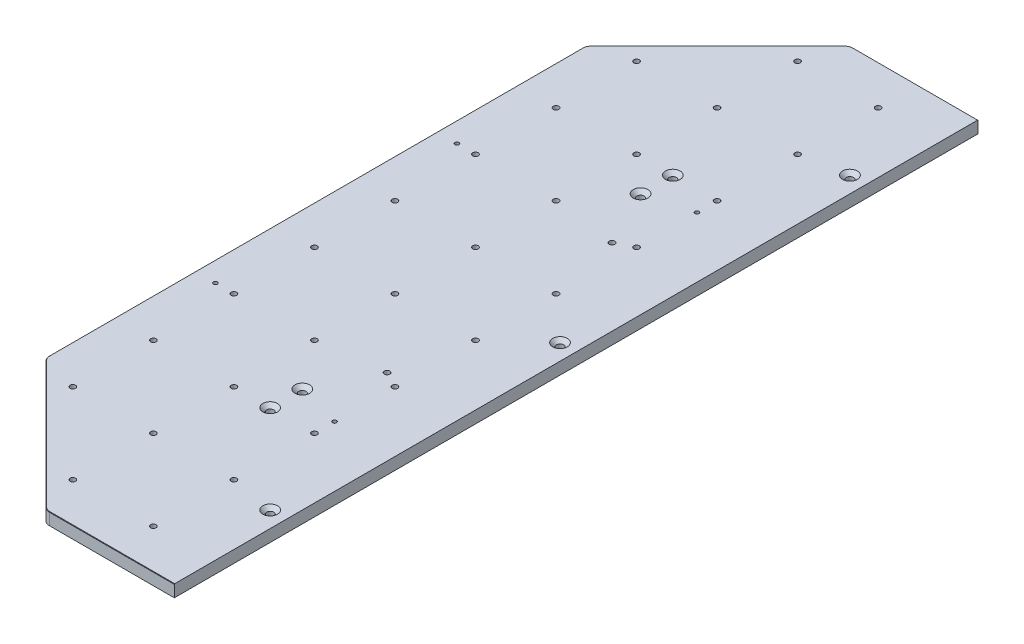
SolidWorks part; units mm, degrees
ref_plane "Ebene vorne" through (0, 0, 0) normal (0, 0, 1) x (1, 0, 0)
ref_plane "Ebene oben" through (0, 0, 0) normal (0, 1, 0) x (1, 0, 0)
ref_plane "Ebene rechts" through (0, 0, 0) normal (1, 0, 0) x (0, 0, -1)
sketch "Skizze1" plane through (0, 0, 0) normal (0, 1, 0) x (1, 0, 0)
  line L0 (-688, 499) -> (-748, 439)
  line L1 (-688, -499) -> (688, -499)
  line L2 (-688, -499) -> (-688, 499) construction
  line L3 (-688, 499) -> (688, 499)
  line L4 (688, -499) -> (688, 499) construction
  line L5 (-688, -499) -> (688, 499) construction
  line L6 (-688, 499) -> (688, -499) construction
  line L7 (-748, 439) -> (-748, -439)
  line L8 (-688, -499) -> (-748, -439)
  line L10 (688, -499) -> (748, -439)
  line L11 (748, -439) -> (748, 439)
  line L12 (748, 439) -> (688, 499)
  line L13 (-748, 0) -> (0, 0) construction
  point P0 (0, 0)
  dimension "D1" = 1496
  dimension "D2" = 998
  dimension "D3" = 60
  dimension "D4" = 45
extrude "Aufsatz-Linear austragen1" add sketch "Skizze1" along normal blind 15
hole_wizard "RoboterP1_M8 Gewindebohrung1" positions "Skizze4" profile "Skizze5" tap size "M8" standard "DIN"
sketch "Skizze4" plane through (0, 15, 0) normal (0, 1, 0) x (1, 0, 0)
  line L0 (-688, -499) -> (688, -499) construction
  line L1 (0, -181.5) -> (-197.5, -181.5) construction
  line L2 (-197.5, -181.5) -> (0, 16) construction
  line L3 (0, 16) -> (197.5, -181.5) construction
  line L4 (197.5, -181.5) -> (0, -379) construction
  line L5 (0, -379) -> (-197.5, -181.5) construction
  line L7 (-139.6536, -321.1536) -> (139.6536, -41.8464) construction
  line L8 (-139.6536, -41.8464) -> (139.6536, -321.1536) construction
  circle A0 centre (0, -181.5) radius 197.5 construction
  point P21 (-139.6536, -321.1536)
  point P22 (139.6536, -41.8464)
  point P23 (-139.6536, -41.8464)
  point P24 (139.6536, -321.1536)
  dimension "D1" = 395
  dimension "D2" = 120
sketch "Skizze5" plane through (139.6536, 15, 321.1536) normal (1, 0, 0) x (0, 0, 1)
  line L0 (0, 0) -> (0, 15)
  line L1 (0, 15) -> (3.4, 15)
  line L2 (3.4, 15) -> (3.4, 0)
  line L5 (3.4, 0) -> (0, 0)
  line L11 (0, -6.35) -> (0, 107.95) construction
  dimension "Bohrerdurchmesser" = 6.8
  dimension "Bohrungstiefe" = 15
hole_wizard "RoboterP2_M8 Gewindebohrung1" positions "Skizze6" profile "Skizze7" tap size "M8" standard "DIN"
sketch "Skizze6" plane through (0, 15, 0) normal (0, 1, 0) x (1, 0, 0)
  line L1 (240.8464, -139.6536) -> (520.1536, -139.6536) construction
  line L2 (240.8464, -139.6536) -> (240.8464, 139.6536) construction
  line L3 (240.8464, 139.6536) -> (520.1536, 139.6536) construction
  line L4 (520.1536, -139.6536) -> (520.1536, 139.6536) construction
  line L5 (240.8464, -139.6536) -> (520.1536, 139.6536) construction
  line L6 (240.8464, 139.6536) -> (520.1536, -139.6536) construction
  line L7 (748, -439) -> (748, 439) construction
  circle A0 centre (380.5, 0) radius 197.5 construction
  point P5 (520.1536, 139.6536)
  point P8 (240.8464, -139.6536)
  point P9 (240.8464, 139.6536)
  point P10 (520.1536, -139.6536)
  dimension "D1" = 395
  dimension "D2" = 170
sketch "Skizze7" plane through (520.1536, 15, 139.6536) normal (1, 0, 0) x (0, 0, 1)
  line L0 (0, 0) -> (0, 15)
  line L1 (0, 15) -> (3.4, 15)
  line L2 (3.4, 15) -> (3.4, 0)
  line L5 (3.4, 0) -> (0, 0)
  line L11 (0, -6.35) -> (0, 107.95) construction
  dimension "Bohrerdurchmesser" = 6.8
  dimension "Bohrungstiefe" = 15
hole_wizard "Raster_M8 Gewindebohrung3" positions "Skizze9" profile "Skizze10" tap size "M8" standard "DIN"
sketch "Skizze9" plane through (0, 15, 0) normal (0, 1, 0) x (1, 0, 0)
  point P0 (-700, -450)
  dimension "D1" = 700
  dimension "D2" = 450
sketch "Skizze10" plane through (-700, 15, 450) normal (1, 0, 0) x (0, 0, 1)
  line L0 (0, 0) -> (0, 15)
  line L1 (0, 15) -> (3.4, 15)
  line L2 (3.4, 15) -> (3.4, 0)
  line L5 (3.4, 0) -> (0, 0)
  line L11 (0, -6.35) -> (0, 107.95) construction
  dimension "Bohrerdurchmesser" = 6.8
  dimension "Bohrungstiefe" = 15
pattern_linear "RoboterP3_M8 Gewindebohrung1" count 2 spacing 150 along (0, 0, -1) of "RoboterP1_M8 Gewindebohrung1"
hole_wizard "Formsenkung für M8 Senkschraube mit Innensechskant1" positions "Skizze2" profile "Skizze3" countersink size "M8" standard "DIN"
sketch "Skizze2" plane through (0, 15, 0) normal (0, 1, 0) x (1, 0, 0)
  line L1 (445, -360) -> (-445, -360)
  line L2 (445, -360) -> (445, 360)
  line L3 (445, 360) -> (-445, 360)
  line L4 (-445, -360) -> (-445, 360)
  line L5 (445, -360) -> (-445, 360) construction
  line L6 (445, 360) -> (-445, -360) construction
  line L7 (0, 0) -> (-610.081, 0) construction
  line L8 (-555, 210) -> (-555, -210) construction
  line L13 (0, 0) -> (0, -385.3386) construction
  line L18 (555, 210) -> (555, -210) construction
  line L19 (-20, 360) -> (-20, -360)
  line L21 (20, 360) -> (20, -360)
  line L22 (-555, 250) -> (-555, 210) construction
  line L24 (-555, -210) -> (-555, -250) construction
  line L26 (555, -210) -> (555, -250) construction
  line L28 (555, 210) -> (555, 250) construction
  line L29 (445, 0) -> (405, 0) construction
  point P2 (-445, 360)
  point P5 (445, -360)
  point P6 (445, 360)
  point P7 (-445, -360)
  point P98 (-555, 210)
  point P100 (-555, -210)
  point P123 (555, 210)
  point P125 (555, -210)
  point P139 (-20, 360)
  point P142 (20, 360)
  point P145 (-20, -360)
  point P148 (20, -360)
  point P150 (-20, 0)
  point P152 (20, 0)
  point P174 (-555, 250)
  point P177 (-555, -250)
  point P180 (555, -250)
  point P183 (555, 250)
  point P184 (-405, 360)
  point P186 (405, 360)
  point P188 (405, -360)
  point P190 (-405, -360)
  point P191 (-445, 0)
  point P193 (-405, 0)
  point P195 (445, 0)
  point P197 (405, 0)
  dimension "D1" = 890
  dimension "D2" = 720
  dimension "D3" = 40
  dimension "D4" = 1110
  dimension "D5" = 500
  dimension "D6" = 40
  dimension "D7" = 40
  dimension "D8" = 40
  dimension "D9" = 40
  dimension "D10" = 40
  dimension "D11" = 40
  dimension "D12" = 40
sketch "Skizze3" plane through (-445, 15, -360) normal (1, 0, 0) x (0, 0, 1)
  line L0 (0, 0) -> (0, 15)
  line L1 (0, 15) -> (4.5, 15)
  line L2 (4.5, 15) -> (4.5, 4.625)
  line L3 (4.5, 4.625) -> (9.125, 0)
  line L5 (9.125, 0) -> (0, 0)
  line L6 (-4.5, 4.625) -> (-9.125, 0) construction
  line L11 (0, -6.35) -> (0, 107.95) construction
  dimension "Bohrerdurchmesser" = 9
  dimension "Bohrungstiefe" = 15
  dimension "Senkdurchmesser (Oben)" = 18.25
  dimension "Senkwinkel (Oben)" = 90
sketch "Skizze8" plane through (0, 15, 0) normal (0, 1, 0) x (1, 0, 0)
  line L1 (100, 300) -> (200, 300)
  line L2 (95, 305) -> (95, 337)
  line L3 (100, 342) -> (200, 342)
  line L4 (205, 305) -> (205, 337)
  line L5 (95, 300) -> (205, 342) construction
  line L6 (95, 342) -> (205, 300) construction
  arc A0 (95, 305) -> (100, 300) centre (100, 305) ccw
  arc A1 (200, 300) -> (205, 305) centre (200, 305) ccw
  arc A2 (205, 337) -> (200, 342) centre (200, 337) ccw
  arc A3 (100, 342) -> (95, 337) centre (100, 337) ccw
  point P0 (150, 321)
  dimension "D5" = 5
  dimension "D1" = 150
  dimension "D2" = 110
  dimension "D3" = 42
  dimension "D4" = 321
extrude "Schnitt-Linear austragen1" cut sketch "Skizze8" against normal through all
hole_wizard "M5 Gewindebohrung1" positions "Skizze17" profile "Skizze18" tap size "M5" standard "DIN"
sketch "Skizze17" plane through (0, 15, 0) normal (0, 1, 0) x (1, 0, 0)
  line L0 (150, 342) -> (150, 300) construction
  line L1 (200, 342) -> (100, 342) construction
  line L2 (100, 300) -> (200, 300) construction
  line L3 (95, 321) -> (150, 321) construction
  line L4 (95, 337) -> (95, 305) construction
  line L5 (150, 321) -> (205, 321) construction
  line L6 (205, 305) -> (205, 337) construction
  point P17 (85, 337)
  point P19 (85, 305)
  point P21 (215, 305)
  point P23 (215, 337)
  dimension "D1" = 32
  dimension "D2" = 130
sketch "Skizze18" plane through (215, 15, -337) normal (1, 0, 0) x (0, 0, 1)
  line L0 (0, 0) -> (0, 13.2618)
  line L1 (0, 13.2618) -> (2.1, 12)
  line L2 (2.1, 12) -> (2.1, 0)
  line L5 (2.1, 0) -> (0, 0)
  line L10 (0, 13.2618) -> (-2.1, 12) construction
  line L11 (0, -6.35) -> (0, 107.95) construction
  dimension "Bohrerdurchmesser" = 4.2
  dimension "Bohrungstiefe" = 12
  dimension "Spitzenwinkel" = 118
sketch "Skizze11" plane through (0, 15, 0) normal (0, 1, 0) x (1, 0, 0)
  line L0 (0, 0) -> (0, 417.1845) construction
  line L1 (688, 499) -> (-688, 499) construction
  line L2 (-270, 469) -> (-270, 499) construction
  line L3 (-305.1, 499) -> (-234.9, 499)
  line L4 (-305.1, 499) -> (-305.1, 474)
  line L5 (-300.1, 469) -> (-239.9, 469)
  line L6 (-234.9, 499) -> (-234.9, 474)
  line L7 (234.9, 499) -> (234.9, 474)
  line L8 (300.1, 469) -> (239.9, 469)
  line L9 (305.1, 499) -> (305.1, 474)
  line L10 (305.1, 499) -> (234.9, 499)
  arc A0 (-234.9, 474) -> (-239.9, 469) centre (-239.9, 474) cw
  arc A1 (-300.1, 469) -> (-305.1, 474) centre (-300.1, 474) cw
  arc A2 (300.1, 469) -> (305.1, 474) centre (300.1, 474) ccw
  arc A3 (234.9, 474) -> (239.9, 469) centre (239.9, 474) ccw
  point P12 (-234.9, 469)
  point P15 (-305.1, 469)
  point P25 (305.1, 469)
  point P26 (234.9, 469)
  dimension "D3" = 5
  dimension "D1" = 30
  dimension "D2" = 70.2
  dimension "D4" = 270
extrude "Schnitt-Linear austragen2" cut sketch "Skizze11" against normal blind 5
fillet "Verrundung2" radius 2 4 edges at (-234.9, 12.5, -499) (-305.1, 12.5, -499) (305.1, 12.5, -499) (234.9, 12.5, -499)
hole_wizard "M6 Gewindebohrung1" positions "Skizze12" profile "Skizze13" tap size "M6" standard "DIN"
sketch "Skizze12" plane through (0, 10, 0) normal (0, 1, 0) x (1, 0, 0)
  line L0 (-270, 95.0617) -> (-270, 484) construction
  line L1 (-270, 484) -> (-287.5, 484) construction
  line L3 (-270, 484) -> (-252.5, 484) construction
  line L6 (-300.1, 469) -> (-239.9, 469) construction
  line L7 (-270, 484) -> (-270, 499) construction
  line L8 (-232.9, 499) -> (-307.1, 499) construction
  point P0 (-287.5, 484)
  point P4 (-252.5, 484)
  dimension "D1" = 35
  dimension "D2" = 15
sketch "Skizze13" plane through (-287.5, 10, -484) normal (1, 0, 0) x (0, 0, 1)
  line L0 (0, 0) -> (0, 10)
  line L1 (0, 10) -> (2.5, 10)
  line L2 (2.5, 10) -> (2.5, 0)
  line L5 (2.5, 0) -> (0, 0)
  line L11 (0, -6.35) -> (0, 107.95) construction
  dimension "Bohrerdurchmesser" = 5
  dimension "Bohrungstiefe" = 10
mirror "Spiegeln3" about plane through (0, 0, 0) normal (1, 0, 0) of "RoboterP2_M8 Gewindebohrung1"
mirror "Spiegeln2" about plane through (0, 0, 0) normal (1, 0, 0) of "M6 Gewindebohrung1"
pattern_linear "Raster_M8 Gewindebohrung4" count 15 spacing 100 along (1, 0, 0) count 10 spacing 100 along (0, 0, -1) of "Raster_M8 Gewindebohrung3"
hole_wizard "Ø5.0mm Stiftloch1" positions "Skizze14" profile "Skizze15" hole size "Ø5.0" standard "DIN"
sketch "Skizze14" plane through (0, 15, 0) normal (0, 1, 0) x (1, 0, 0)
  line L1 (-500, -225) -> (500, -225)
  line L2 (-500, -225) -> (-500, 225)
  line L3 (-500, 225) -> (500, 225)
  line L4 (500, -225) -> (500, 225)
  line L5 (-500, -225) -> (500, 225) construction
  line L6 (-500, 225) -> (500, -225) construction
  point P2 (500, 225)
  point P5 (-500, -225)
  point P6 (-500, 225)
  point P7 (500, -225)
  dimension "D1" = 1000
  dimension "D2" = 450
sketch "Skizze15" plane through (500, 15, -225) normal (1, 0, 0) x (0, 0, 1)
  line L0 (0, 0) -> (0, 9.5022)
  line L1 (0, 9.5022) -> (2.5, 8)
  line L2 (2.5, 8) -> (2.5, 0)
  line L5 (2.5, 0) -> (0, 0)
  line L10 (0, 9.5022) -> (-2.5, 8) construction
  line L11 (0, -6.35) -> (0, 107.95) construction
  dimension "Bohrerdurchmesser" = 5
  dimension "Bohrungstiefe" = 8
  dimension "Spitzenwinkel" = 118
sketch "Skizze19" plane through (0, 15, 0) normal (0, 1, 0) x (1, 0, 0)
  line L0 (-748, -335.3333) -> (-584.3333, -499)
  line L1 (-748, 439) -> (-748, -439) construction
  line L2 (-688, -499) -> (688, -499) construction
  line L3 (-700, -450) -> (-666.6667, -416.6667) construction
  line L4 (-666.6667, -416.6667) -> (-633.3333, -383.3333) construction
  line L5 (-633.3333, -383.3333) -> (-600, -350) construction
  line L7 (-748, -335.3333) -> (-748, -499)
  line L8 (-748, -499) -> (-584.3333, -499)
  line L9 (0, 0) -> (-867.3636, 0) construction
  line L10 (0, 0) -> (0, 198.8508) construction
  line L11 (748, 335.3333) -> (584.3333, 499)
  line L12 (748, 335.3333) -> (748, 499)
  line L13 (748, 499) -> (584.3333, 499)
  line L14 (748, -499) -> (584.3333, -499)
  line L15 (-748, 499) -> (-584.3333, 499)
  line L16 (-748, 335.3333) -> (-748, 499)
  line L17 (-748, 335.3333) -> (-584.3333, 499)
  line L18 (748, -335.3333) -> (748, -499)
  line L19 (748, -335.3333) -> (584.3333, -499)
extrude "Schnitt-Linear austragen4" cut sketch "Skizze19" against normal through all
fillet "Verrundung1" radius 10 8 edges at (-584.3333, 7.5, 499) (584.3333, 7.5, 499) (748, 7.5, 335.3333) (748, 7.5, -335.3333) (584.3333, 7.5, -499) (-584.3333, 7.5, -499) (-748, 7.5, -335.3333) (-748, 7.5, 335.3333)
chamfer "Fase1" distance 0.5 angle 45 40 edges at (0, 15, -499) (-234.3142, 15, -498.4142) (234.3142, 15, -498.4142) (-234.9, 15, -485.5) (234.9, 15, -485.5) (-236.3645, 15, -470.4645) (236.3645, 15, -470.4645) (-270, 15, -469) (270, 15, -469) (-303.6355, 15, -470.4645) (303.6355, 15, -470.4645) (-305.1, 15, -485.5) (305.1, 15, -485.5) (-305.6858, 15, -498.4142) (305.6858, 15, -498.4142) (-443.6456, 15, -499) (443.6456, 15, -499) (-748, 15, 0) (748, 15, 0) (0, 15, 499) (150, 15, -300) (203.5355, 15, -301.4645) (96.4645, 15, -301.4645) (205, 15, -321) (95, 15, -321) (203.5355, 15, -340.5355) (96.4645, 15, -340.5355) (150, 15, -342) (-666.1667, 15, 417.1667) (-584.018, 15, 498.2388) (-584.018, 15, -498.2388) (584.018, 15, -498.2388) (-666.1667, 15, -417.1667) (666.1667, 15, -417.1667) (-747.2388, 15, -335.018) (747.2388, 15, -335.018) (-747.2388, 15, 335.018) (747.2388, 15, 335.018) (666.1667, 15, 417.1667) (584.018, 15, 498.2388)
sketch "Skizze20" plane through (0, 15, 0) normal (0, 1, 0) x (1, 0, 0)
  line L0 (-388.9113, 0) -> (-892.3577, 0) construction
  line L1 (-723, 150) -> (-723, -150) construction
  line L2 (-748, -331.1912) -> (-748, 331.1912) construction
  point P0 (-723, 150)
  point P1 (-723, -150)
  dimension "D1" = 300
  dimension "D2" = 25
ref_plane "Ebene1" through (425, 0, 0) normal (1, 0, 0) x (0, 0, -1)
ref_plane "Ebene2" through (-425, 0, 0) normal (1, 0, 0) x (0, 0, -1)
split "Abspalten1" trim tools "Ebene1", "Ebene2" bodies to split 128 resulting bodies 131
split "Abspalten2" [suppressed] bodies to split 128
split "Abspalten3" [suppressed] bodies to split 128
hole_wizard "M6 Gewindebohrung2" positions "Skizze21" profile "Skizze22" tap size "M6" standard "DIN"
sketch "Skizze21" plane through (0, 15, 0) normal (0, 1, 0) x (1, 0, 0)
  point P0 (-723, 150)
  point P3 (-723, -150)
sketch "Skizze22" plane through (-723, 15, -150) normal (1, 0, 0) x (0, 0, 1)
  line L0 (0, 0) -> (0, 15)
  line L1 (0, 15) -> (2.5, 15)
  line L2 (2.5, 15) -> (2.5, 0)
  line L5 (2.5, 0) -> (0, 0)
  line L11 (0, -6.35) -> (0, 107.95) construction
  dimension "Bohrerdurchmesser" = 5
  dimension "Bohrungstiefe" = 15
hole_wizard "M8 Gewindebohrung1" positions "3D-Skizze1" profile "Skizze23" tap size "M8" standard "DIN"
sketch3d "3D-Skizze1"
  circle A0 centre (-600, 15, 450) radius 3.4 construction
  circle A1 centre (-500, 15, 450) radius 3.4 construction
  circle A2 centre (-500, 15, 350) radius 3.4 construction
  circle A3 centre (-600, 15, 350) radius 3.4 construction
  circle A4 centre (-700, 15, 350) radius 3.4 construction
  circle A5 centre (-700, 15, 250) radius 3.4 construction
  circle A6 centre (-600, 15, 250) radius 3.4 construction
  circle A7 centre (-600, 15, 150) radius 3.4 construction
  circle A8 centre (-700, 15, 150) radius 3.4 construction
  circle A9 centre (-700, 15, 50) radius 3.4 construction
  circle A10 centre (-700, 15, -50) radius 3.4 construction
  circle A11 centre (-700, 15, -150) radius 3.4 construction
  circle A12 centre (-700, 15, -250) radius 3.4 construction
  circle A13 centre (-700, 15, -350) radius 3.4 construction
  circle A14 centre (-600, 15, -450) radius 3.4 construction
  circle A15 centre (-600, 15, -350) radius 3.4 construction
  circle A16 centre (-600, 15, -250) radius 3.4 construction
  circle A17 centre (-600, 15, -150) radius 3.4 construction
  circle A18 centre (-600, 15, -50) radius 3.4 construction
  circle A19 centre (-600, 15, 50) radius 3.4 construction
  circle A20 centre (-500, 15, 250) radius 3.4 construction
  circle A21 centre (-500, 15, 150) radius 3.4 construction
  circle A22 centre (-500, 15, 50) radius 3.4 construction
  circle A23 centre (-500, 15, -50) radius 3.4 construction
  circle A24 centre (-500, 15, -150) radius 3.4 construction
  circle A25 centre (-500, 15, -250) radius 3.4 construction
  circle A26 centre (-500, 15, -350) radius 3.4 construction
  circle A27 centre (-500, 15, -450) radius 3.4 construction
  point P2 (-600, 15, 450)
  point P4 (-600, 15, 350)
  point P6 (-500, 15, 450)
  point P8 (-500, 15, 350)
  point P10 (-500, 15, 250)
  point P12 (-500, 15, 150)
  point P14 (-500, 15, 50)
  point P16 (-600, 15, 150)
  point P18 (-600, 15, 250)
  point P20 (-700, 15, 250)
  point P22 (-700, 15, 350)
  point P24 (-700, 15, 150)
  point P26 (-700, 15, 50)
  point P28 (-700, 15, -50)
  point P30 (-600, 15, 50)
  point P32 (-600, 15, -50)
  point P34 (-500, 15, -50)
  point P36 (-700, 15, -150)
  point P38 (-700, 15, -250)
  point P40 (-600, 15, -150)
  point P42 (-600, 15, -250)
  point P44 (-500, 15, -150)
  point P46 (-500, 15, -250)
  point P48 (-500, 15, -350)
  point P50 (-600, 15, -350)
  point P52 (-600, 15, -450)
  point P54 (-500, 15, -450)
  point P56 (-700, 15, -350)
  point P62 (-600, 18.4, 450)
  point P67 (-500, 18.4, 450)
  point P70 (-500, 18.4, 350)
  point P73 (-600, 18.4, 350)
  point P77 (-700, 18.4, 350)
  point P81 (-700, 18.4, 250)
  point P85 (-600, 18.4, 250)
  point P89 (-600, 18.4, 150)
  point P93 (-700, 18.4, 150)
  point P97 (-700, 18.4, 50)
  point P100 (-700, 18.4, -50)
  point P104 (-700, 18.4, -150)
  point P108 (-700, 18.4, -250)
  point P112 (-700, 18.4, -350)
  point P116 (-600, 18.4, -450)
  point P119 (-600, 18.4, -350)
  point P123 (-600, 18.4, -250)
  point P126 (-600, 18.4, -150)
  point P130 (-600, 18.4, -50)
  point P133 (-600, 18.4, 50)
  point P136 (-500, 18.4, 250)
  point P140 (-500, 18.4, 150)
  point P143 (-500, 18.4, 50)
  point P146 (-500, 18.4, -50)
  point P149 (-500, 18.4, -150)
  point P152 (-500, 18.4, -250)
  point P155 (-500, 18.4, -350)
  point P159 (-500, 18.4, -450)
sketch "Skizze23" plane through (-600, 15, 450) normal (1, 0, 0) x (0, 0, 1)
  line L0 (0, 0) -> (0, 15)
  line L1 (0, 15) -> (3.4, 15)
  line L2 (3.4, 15) -> (3.4, 0)
  line L5 (3.4, 0) -> (0, 0)
  line L11 (0, -6.35) -> (0, 107.95) construction
  dimension "Bohrerdurchmesser" = 6.8
  dimension "Bohrungstiefe" = 15
